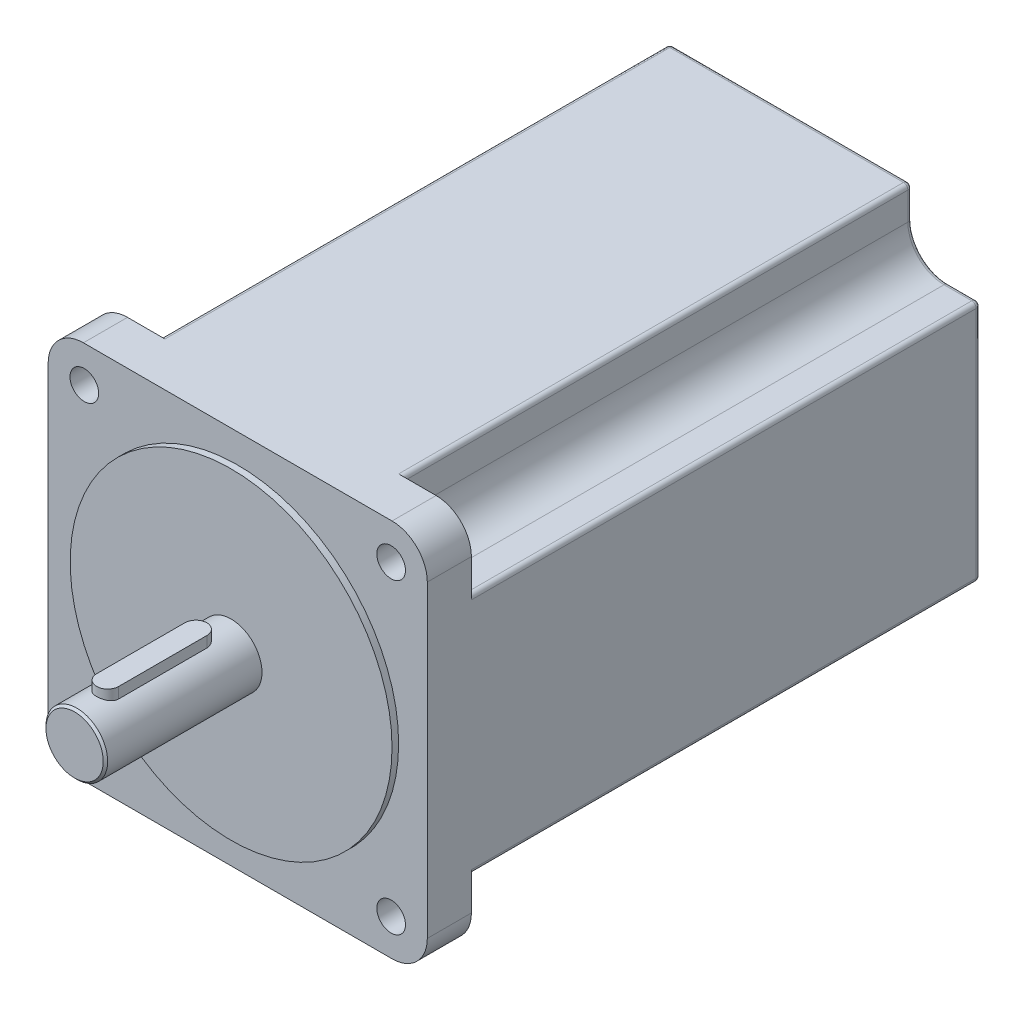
SolidWorks part; units mm, degrees
ref_plane "前视基准面" through (0, 0, 0) normal (0, 0, 1) x (1, 0, 0)
ref_plane "上视基准面" through (0, 0, 0) normal (0, 1, 0) x (1, 0, 0)
ref_plane "右视基准面" through (0, 0, 0) normal (1, 0, 0) x (0, 0, -1)
sketch "草图1" plane through (0, 0, 0) normal (0, 0, 1) x (1, 0, 0)
  circle A0 centre (0, 0) radius 36.5
extrude "凸台-拉伸1" add sketch "草图1" against normal blind 1.5
sketch "草图2" plane through (0, 0, 0) normal (0, 0, 1) x (1, 0, 0)
  circle A0 centre (0, 0) radius 7
extrude "凸台-拉伸2" add sketch "草图2" along normal blind 35.5
sketch "草图4" plane through (0, 0, -1.5) normal (0, 0, -1) x (-1, 0, 0)
  line L1 (0, 43) -> (35, 43)
  line L2 (43, 35) -> (43, -35)
  line L3 (35, -43) -> (-35, -43)
  line L4 (-43, -35) -> (-43, 35)
  line L5 (-35, 43) -> (0, 43)
  arc A0 (-35, -43) -> (-43, -35) centre (-35, -35) cw
  arc A1 (43, -35) -> (35, -43) centre (35, -35) cw
  arc A2 (35, 43) -> (43, 35) centre (35, 35) cw
  arc A3 (-43, 35) -> (-35, 43) centre (-35, 35) cw
  circle A4 centre (-34.8, 34.8) radius 3.25
  circle A5 centre (34.8, 34.8) radius 3.25
  circle A6 centre (34.8, -34.8) radius 3.25
  circle A7 centre (-34.8, -34.8) radius 3.25
  dimension "D1" = 8
extrude "凸台-拉伸3" add sketch "草图4" along normal blind 125.5
sketch "草图5" plane through (0, 0, -127) normal (0, 0, -1) x (-1, 0, 0)
  line L1 (35, 43) -> (-35, 43) construction
  line L2 (13.75, 43) -> (26.5, 43)
  line L3 (27.5, 42) -> (27.5, 35.7)
  line L4 (35.7, 27.5) -> (42, 27.5)
  line L5 (43, -35) -> (43, 35) construction
  line L6 (43, 26.5) -> (43, 18.141)
  line L7 (43, 18.141) -> (50.5715, 18.141)
  line L8 (50.5715, 18.141) -> (50.5715, 56.8276)
  line L9 (50.5715, 56.8276) -> (13.75, 56.8276)
  line L10 (13.75, 56.8276) -> (13.75, 43)
  line L12 (-13.75, 56.8276) -> (-13.75, 43)
  line L13 (-50.5715, 56.8276) -> (-13.75, 56.8276)
  line L14 (-50.5715, 18.141) -> (-50.5715, 56.8276)
  line L15 (-43, 18.141) -> (-50.5715, 18.141)
  line L16 (-43, 26.5) -> (-43, 18.141)
  line L17 (-35.7, 27.5) -> (-42, 27.5)
  line L18 (-27.5, 42) -> (-27.5, 35.7)
  line L19 (-13.75, 43) -> (-26.5, 43)
  line L20 (13.75, -56.8276) -> (13.75, -43)
  line L21 (50.5715, -56.8276) -> (13.75, -56.8276)
  line L22 (50.5715, -18.141) -> (50.5715, -56.8276)
  line L23 (43, -18.141) -> (50.5715, -18.141)
  line L24 (43, -26.5) -> (43, -18.141)
  line L25 (35.7, -27.5) -> (42, -27.5)
  line L26 (27.5, -42) -> (27.5, -35.7)
  line L27 (13.75, -43) -> (26.5, -43)
  line L28 (-13.75, -43) -> (-26.5, -43)
  line L29 (-27.5, -42) -> (-27.5, -35.7)
  line L30 (-35.7, -27.5) -> (-42, -27.5)
  line L31 (-43, -26.5) -> (-43, -18.141)
  line L32 (-43, -18.141) -> (-50.5715, -18.141)
  line L33 (-50.5715, -18.141) -> (-50.5715, -56.8276)
  line L34 (-50.5715, -56.8276) -> (-13.75, -56.8276)
  line L35 (-13.75, -56.8276) -> (-13.75, -43)
  arc A0 (27.5, 35.7) -> (35.7, 27.5) centre (35.7, 35.7) ccw
  arc A1 (42, 27.5) -> (43, 26.5) centre (42, 26.5) cw
  arc A2 (26.5, 43) -> (27.5, 42) centre (26.5, 42) cw
  arc A3 (-26.5, 43) -> (-27.5, 42) centre (-26.5, 42) ccw
  arc A4 (-42, 27.5) -> (-43, 26.5) centre (-42, 26.5) ccw
  arc A5 (-27.5, 35.7) -> (-35.7, 27.5) centre (-35.7, 35.7) cw
  arc A6 (26.5, -43) -> (27.5, -42) centre (26.5, -42) ccw
  arc A7 (42, -27.5) -> (43, -26.5) centre (42, -26.5) ccw
  arc A8 (27.5, -35.7) -> (35.7, -27.5) centre (35.7, -35.7) cw
  arc A9 (-27.5, -35.7) -> (-35.7, -27.5) centre (-35.7, -35.7) ccw
  arc A10 (-42, -27.5) -> (-43, -26.5) centre (-42, -26.5) cw
  arc A11 (-26.5, -43) -> (-27.5, -42) centre (-26.5, -42) cw
  point P19 (43, 27.5)
  point P22 (27.5, 43)
  point P38 (-27.5, 43)
  point P39 (-43, 27.5)
  point P54 (27.5, -43)
  point P55 (43, -27.5)
  point P70 (-43, -27.5)
  point P71 (-27.5, -43)
  dimension "D1" = 8.2
  dimension "D2" = 1
extrude "切除-拉伸2" cut sketch "草图5" against normal blind 115.5
ref_plane "基准面1" through (0, 7, 0) normal (0, 1, 0) x (1, 0, 0)
sketch "草图7" plane through (0, 7, 0) normal (0, 1, 0) x (1, 0, 0)
  line L3 (-2.5, -8) -> (-2.5, -28)
  line L5 (2.5, -28) -> (2.5, -8)
  arc A0 (-2.5, -28) -> (2.5, -28) centre (0, -28) ccw
  arc A1 (2.5, -8) -> (-2.5, -8) centre (0, -8) ccw
extrude "切除-拉伸3" cut sketch "草图7" against normal blind 3
sketch "草图8" plane through (0, 4, 0) normal (0, 1, 0) x (1, 0, 0)
  line L0 (-2.5, -28) -> (-2.5, -8)
  line L2 (2.5, -28) -> (2.5, -8)
  arc A0 (2.5, -8) -> (-2.5, -8) centre (0, -8) ccw
  arc A1 (-2.5, -28) -> (2.5, -28) centre (0, -28) ccw
extrude "凸台-拉伸4" add sketch "草图8" along normal blind 5 separate body
chamfer "倒角2" distance 0.5 angle 45 1 edges at (7, 0, 35.5)
fillet "圆角1" radius 1 24 edges at (29.9017, -29.9017, -127) (38.85, -27.5, -127) (42.7071, -27.2071, -127) (43, 0, -127) (42.7071, 27.2071, -127) (38.85, 27.5, -127) (29.9017, 29.9017, -127) (27.5, 38.85, -127) (27.2071, 42.7071, -127) (0, 43, -127) (-27.2071, 42.7071, -127) (-27.5, 38.85, -127) (-29.9017, 29.9017, -127) (-38.85, 27.5, -127) (-42.7071, 27.2071, -127) (-43, 0, -127) (-42.7071, -27.2071, -127) (-38.85, -27.5, -127) (-29.9017, -29.9017, -127) (-27.5, -38.85, -127) (-27.2071, -42.7071, -127) (0, -43, -127) (27.2071, -42.7071, -127) (27.5, -38.85, -127)
